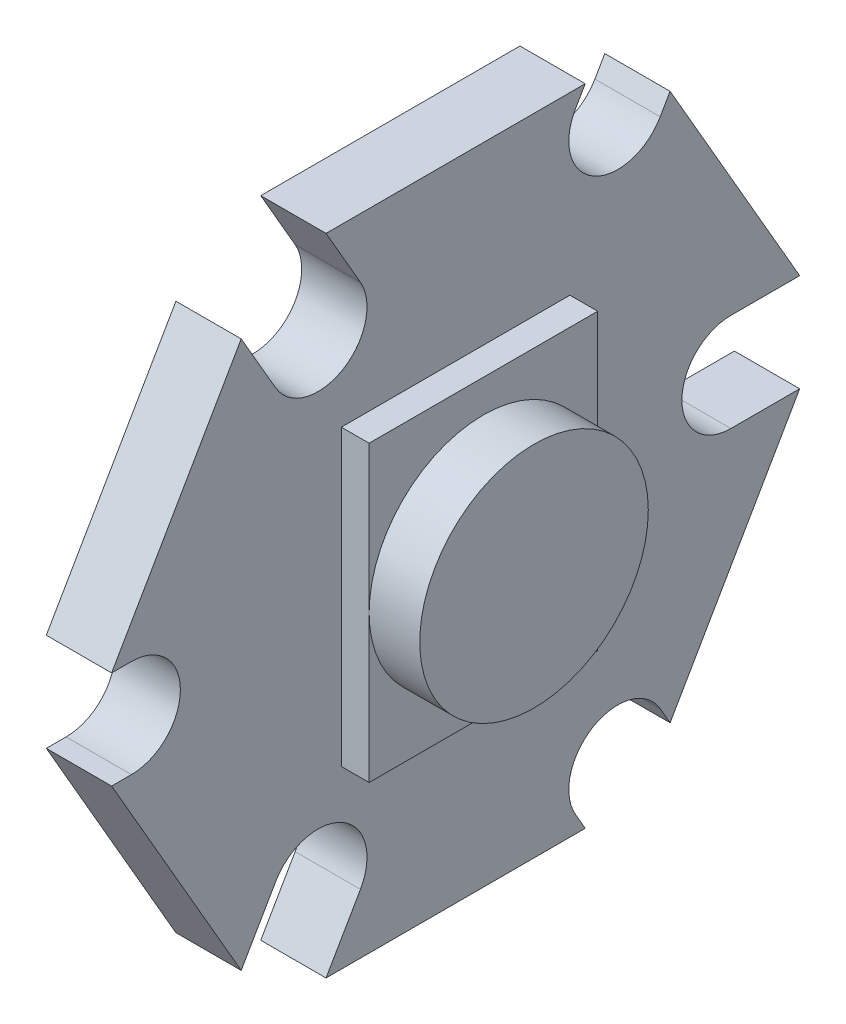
SolidWorks part; units mm, degrees
ref_plane "Front Plane" through (0, 0, 0) normal (0, 0, 1) x (1, 0, 0)
ref_plane "Top Plane" through (0, 0, 0) normal (0, 1, 0) x (1, 0, 0)
ref_plane "Right Plane" through (0, 0, 0) normal (1, 0, 0) x (0, 0, -1)
sketch "Sketch1" plane through (0, 0, 0) normal (1, 0, 0) x (0, 0, -1)
  line L0 (0, 0) -> (0, 12.4256) construction
  line L1 (5.7013, 9.875) -> (-5.7013, 9.875)
  line L2 (-5.7013, 9.875) -> (-11.4027, 0)
  line L3 (-11.4027, 0) -> (-5.7013, -9.875)
  line L4 (-5.7013, -9.875) -> (5.7013, -9.875)
  line L5 (5.7013, -9.875) -> (11.4027, 0)
  line L6 (11.4027, 0) -> (5.7013, 9.875)
  circle A0 centre (0, 0) radius 9.875 construction
  dimension "D1" = 19.75
  dimension "D2" = 30
extrude "Boss-Extrude1" add sketch "Sketch1" along normal mid plane 2
sketch "Sketch2" plane through (1, 0, 0) normal (1, 0, 0) x (0, 0, -1)
  line L0 (-4.2147, 7.3) -> (-4.2147, -7.3) construction
  line L1 (-4.2147, -7.3) -> (8.4293, 0) construction
  line L4 (0, 0) -> (8.4293, 0) construction
  line L5 (0, 0) -> (-4.2147, 7.3) construction
  line L6 (8.4293, 0) -> (11.9352, 0) construction
  line L7 (8.4293, 1.5) -> (11.9352, 1.5)
  line L8 (8.4293, -1.5) -> (11.9352, -1.5)
  line L9 (-4.2147, 7.3) -> (-6.3003, 10.9124) construction
  line L10 (-5.5137, 6.55) -> (-7.5993, 10.1624)
  line L11 (-2.9156, 8.05) -> (-5.0012, 11.6624)
  line L13 (5.7013, 9.875) -> (-5.7013, 9.875) construction
  line L14 (-4.2147, -7.3) -> (-6.3335, -10.97) construction
  line L15 (-2.9156, -8.05) -> (-5.0345, -11.72)
  line L16 (-5.5137, -6.55) -> (-7.6325, -10.22)
  line L18 (-5.7013, -9.875) -> (5.7013, -9.875) construction
  arc A0 (-2.9156, -8.05) -> (-5.5137, -6.55) centre (-4.2147, -7.3) ccw
  arc A2 (-5.5137, 6.55) -> (-2.9156, 8.05) centre (-4.2147, 7.3) ccw
  arc A3 (8.4293, 1.5) -> (8.4293, -1.5) centre (8.4293, 0) ccw
  arc A4 (11.9352, -1.5) -> (11.9352, 1.5) centre (11.9352, 0) ccw
  arc A5 (-5.0012, 11.6624) -> (-7.5993, 10.1624) centre (-6.3003, 10.9124) ccw
  arc A6 (-7.6325, -10.22) -> (-5.0345, -11.72) centre (-6.3335, -10.97) ccw
  point P5 (-5.2575, 9.1062)
  point P7 (10.1822, 0)
  point P21 (-5.2741, -9.135)
  dimension "D3" = 60
  dimension "D5" = 60
  dimension "D6" = 1.5
  dimension "D7" = 60
  dimension "D9" = 1.5
  dimension "D13" = 4.2377
  dimension "D12" = 1.5
  dimension "D1" = 14.6
  dimension "D2" = 14.6
  dimension "D4" = 30
  dimension "D8" = 30
  dimension "D10" = 3.5059
  dimension "D11" = 4.1712
extrude "Cut-Extrude2" cut sketch "Sketch2" against normal through all
sketch "Sketch4" plane through (1, 0, 0) normal (1, 0, 0) x (0, 0, -1)
  line L0 (-9.9304, 0) -> (-12.9304, 0) construction
  line L1 (-9.9304, -1.5) -> (-12.9304, -1.5)
  line L2 (-9.9304, 1.5) -> (-12.9304, 1.5)
  line L3 (5.7013, 9.875) -> (0, 0) construction
  line L4 (0, 0) -> (5.7013, -9.875) construction
  line L5 (4.9652, 8.6) -> (6.4652, 11.1981) construction
  line L6 (3.6662, 9.35) -> (5.1662, 11.9481)
  line L7 (6.2643, 7.85) -> (7.7643, 10.4481)
  line L8 (4.9652, -8.6) -> (6.4652, -11.1981) construction
  line L9 (6.2643, -7.85) -> (7.7643, -10.4481)
  line L10 (3.6662, -9.35) -> (5.1662, -11.9481)
  line L11 (4.9652, 8.6) -> (-9.9304, 0) construction
  line L12 (-9.9304, 0) -> (4.9652, -8.6) construction
  arc A0 (-9.9304, -1.5) -> (-9.9304, 1.5) centre (-9.9304, 0) ccw
  arc A1 (-12.9304, 1.5) -> (-12.9304, -1.5) centre (-12.9304, 0) ccw
  arc A2 (3.6662, 9.35) -> (6.2643, 7.85) centre (4.9652, 8.6) ccw
  arc A3 (7.7643, 10.4481) -> (5.1662, 11.9481) centre (6.4652, 11.1981) ccw
  arc A4 (6.2643, -7.85) -> (3.6662, -9.35) centre (4.9652, -8.6) ccw
  arc A5 (5.1662, -11.9481) -> (7.7643, -10.4481) centre (6.4652, -11.1981) ccw
  point P3 (-11.4304, 0)
  point P15 (5.7152, 9.899)
  point P20 (5.7152, -9.899)
  dimension "D1" = 1.5
  dimension "D2" = 1.5
  dimension "D3" = 1.5
  dimension "D4" = 17.2
  dimension "D5" = 17.2
  dimension "D6" = 60
  dimension "D7" = 3
  dimension "D8" = 3
  dimension "D9" = 3
extrude "Cut-Extrude3" cut sketch "Sketch4" against normal through all
sketch "Sketch5" plane through (1, 0, 0) normal (1, 0, 0) x (0, 0, -1)
  line L1 (-3.5, -4.5) -> (3.5, -4.5)
  line L2 (-3.5, -4.5) -> (-3.5, 4.5)
  line L3 (-3.5, 4.5) -> (3.5, 4.5)
  line L4 (3.5, -4.5) -> (3.5, 4.5)
  line L5 (-3.5, -4.5) -> (3.5, 4.5) construction
  line L6 (-3.5, 4.5) -> (3.5, -4.5) construction
  point P0 (0, 0)
  dimension "D1" = 7
  dimension "D2" = 9
extrude "Boss-Extrude2" add sketch "Sketch5" along normal blind 0.85
sketch "Sketch7" plane through (1.85, 0, 0) normal (1, 0, 0) x (0, 0, -1)
  circle A0 centre (0, 0) radius 3.5
  dimension "D1" = 7
extrude "Boss-Extrude3" add sketch "Sketch7" along normal blind 1.55
